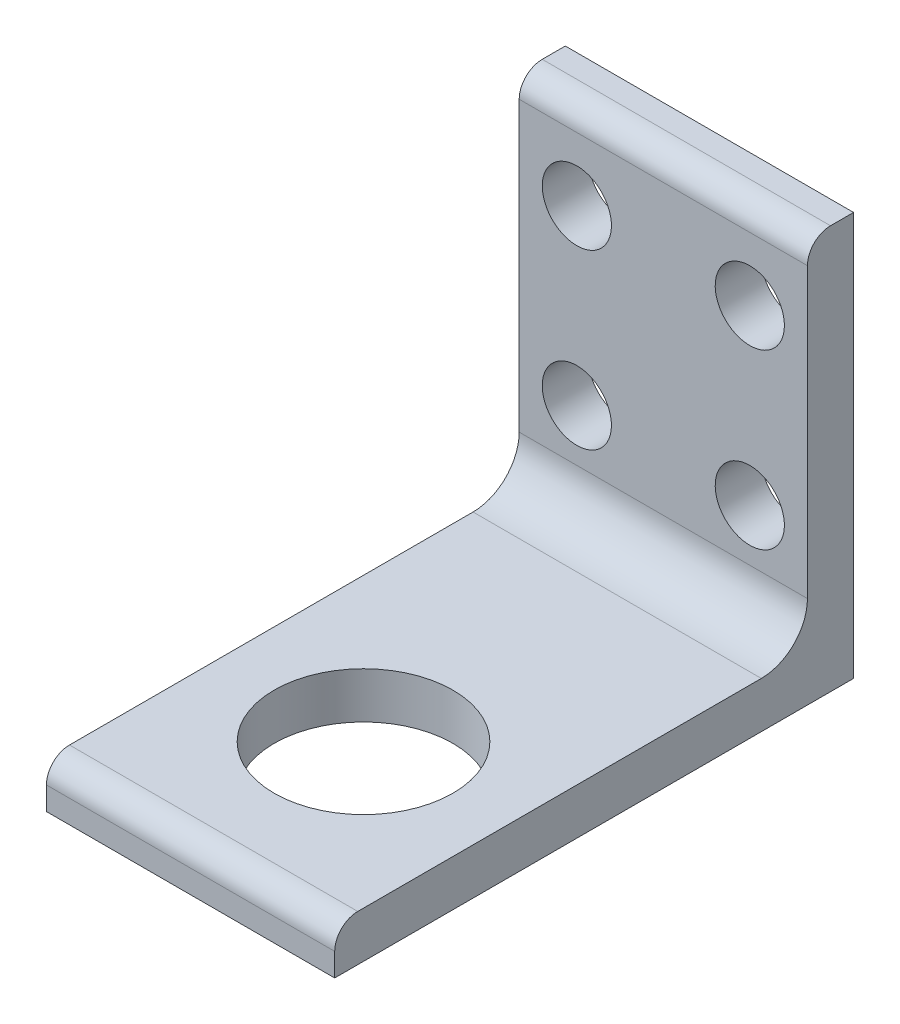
SolidWorks part; units mm, degrees
ref_plane "Plan de face" through (0, 0, 0) normal (0, 0, 1) x (1, 0, 0)
ref_plane "Plan de dessus" through (0, 0, 0) normal (0, 1, 0) x (1, 0, 0)
ref_plane "Plan de droite" through (0, 0, 0) normal (1, 0, 0) x (0, 0, -1)
sketch "Esquisse1" plane through (0, 0, 0) normal (0, 0, 1) x (1, 0, 0)
  line L0 (-25, 0) -> (25, 0)
  dimension "D1" = 50
other "Cornières à ailes inégales et à coins arrondis 90X70 SÉRIE1 E8(1)"
ref_plane "Plan1" through (-25, 0, 0) normal (1, 0, 0) x (0, 1, 0)
sketch "Esquisse19" plane through (-25, 0, 0) normal (1, 0, 0) x (0, 1, 0)
  line L0 (0, 90) -> (0, 0)
  line L1 (0, 0) -> (70, 0)
  line L2 (70, 0) -> (70, 4)
  line L3 (66, 8) -> (16, 8)
  line L4 (8, 16) -> (8, 86)
  line L5 (4, 90) -> (0, 90)
  line L6 (16, 16) -> (0, 16) construction
  line L7 (16, 16) -> (16, 0) construction
  arc A0 (70, 4) -> (66, 8) centre (66, 4) ccw
  arc A1 (8, 86) -> (4, 90) centre (4, 86) ccw
  arc A2 (16, 8) -> (8, 16) centre (16, 16) cw
  point P13 (0, 0)
  dimension "D1" = 90
  dimension "D4" = 8
  dimension "D5" = 4
  dimension "D2" = 70
  dimension "D3" = 8
sketch "Esquisse12" plane through (0, 0, 0) normal (0, 1, 0) x (-1, 0, 0)
  line L0 (0, 0) -> (0, 60) construction
  circle A0 centre (0, 60) radius 15.5
  dimension "D1" = 31
  dimension "D2" = 60
extrude "Enlèv. mat.-Extru.1" cut sketch "Esquisse12" along normal blind 10
sketch "Esquisse13" plane through (0, 0, 0) normal (0, 0, 1) x (1, 0, 0)
  line L0 (0, 40) -> (0, 0) construction
  line L1 (15, 25) -> (-15, 25) construction
  line L2 (15, 25) -> (15, 55) construction
  line L3 (15, 55) -> (-15, 55) construction
  line L4 (-15, 25) -> (-15, 55) construction
  line L5 (15, 25) -> (-15, 55) construction
  line L6 (15, 55) -> (-15, 25) construction
  circle A0 centre (-15, 55) radius 6
  circle A1 centre (15, 55) radius 6
  circle A2 centre (15, 25) radius 6
  circle A3 centre (-15, 25) radius 6
  point P0 (0, 40)
  dimension "D1" = 12
  dimension "D2" = 40
  dimension "D3" = 30
  dimension "D4" = 30
extrude "Enlèv. mat.-Extru.2" cut sketch "Esquisse13" along normal blind 10
